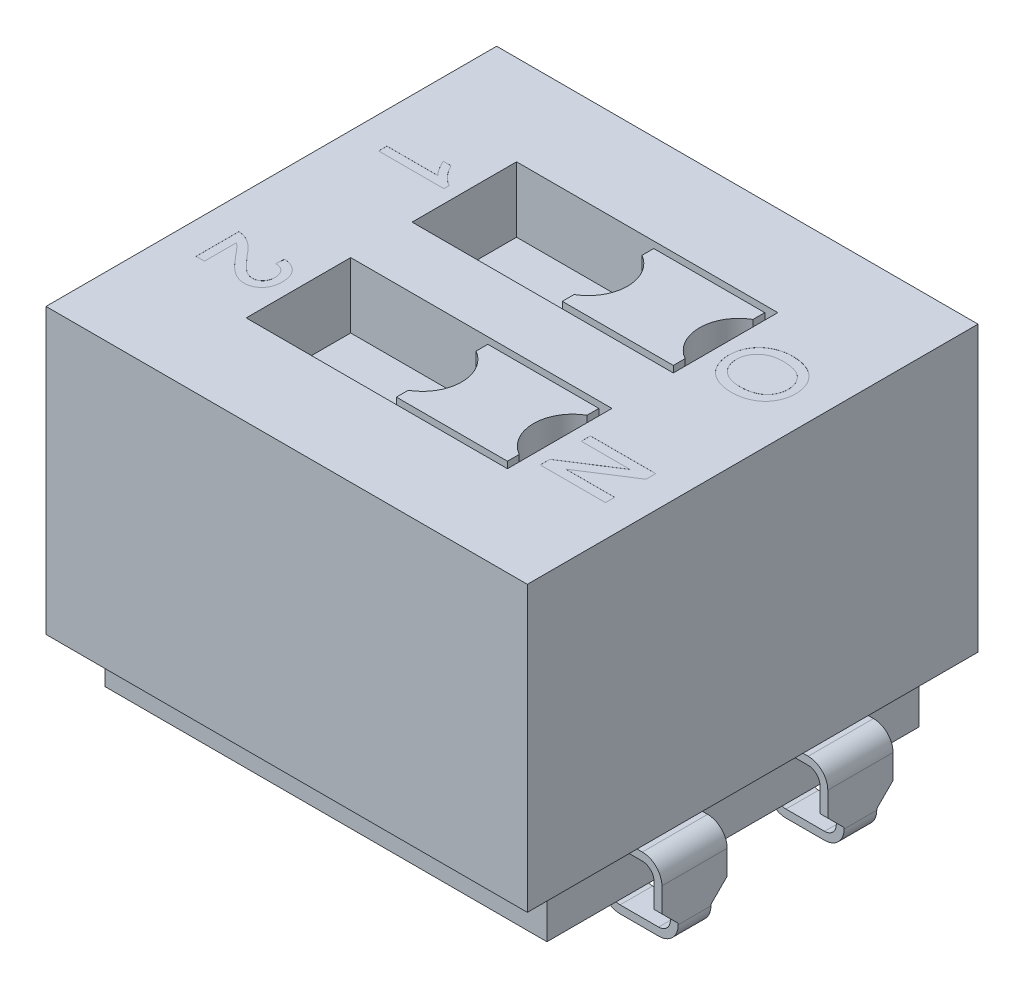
SolidWorks part; units mm, degrees
ref_plane "Front" through (0, 0, 0) normal (0, 0, 1) x (1, 0, 0)
ref_plane "Top" through (0, 0, 0) normal (0, 1, 0) x (1, 0, 0)
ref_plane "Right" through (0, 0, 0) normal (1, 0, 0) x (0, 0, -1)
ref_plane "Плоскость2" through (0, 0, -1.27) normal (0, 0, 1) x (1, 0, 0)
sketch "Эскиз1" plane through (0, 0, -1.27) normal (0, 0, 1) x (1, 0, 0)
  line L0 (-3.175, 0) -> (-3.765, 0)
  line L1 (-4.065, 0.3) -> (-4.065, 0.94)
  line L2 (-3.765, 1.24) -> (0, 1.24)
  line L3 (0, 1.24) -> (0, 0) construction
  line L4 (-2.875, 0.3) -> (-2.875, 0.32)
  line L5 (-2.995, 0.3) -> (-2.995, 0.32)
  line L6 (-3.175, 0.12) -> (-3.765, 0.12)
  line L7 (-3.945, 0.3) -> (-3.945, 0.94)
  line L8 (-3.765, 1.12) -> (0, 1.12)
  line L9 (-2.995, 0.32) -> (-2.875, 0.32)
  line L10 (2.995, 0.32) -> (2.875, 0.32)
  line L11 (3.765, 1.12) -> (0, 1.12)
  line L12 (3.945, 0.3) -> (3.945, 0.94)
  line L13 (3.175, 0.12) -> (3.765, 0.12)
  line L14 (2.995, 0.3) -> (2.995, 0.32)
  line L15 (2.875, 0.3) -> (2.875, 0.32)
  line L16 (3.765, 1.24) -> (0, 1.24)
  line L17 (4.065, 0.3) -> (4.065, 0.94)
  line L18 (3.175, 0) -> (3.765, 0)
  arc A0 (-3.175, 0) -> (-2.875, 0.3) centre (-3.175, 0.3) ccw
  arc A1 (-3.765, 0) -> (-4.065, 0.3) centre (-3.765, 0.3) cw
  arc A2 (-4.065, 0.94) -> (-3.765, 1.24) centre (-3.765, 0.94) cw
  arc A3 (-3.175, 0.12) -> (-2.995, 0.3) centre (-3.175, 0.3) ccw
  arc A4 (-3.765, 0.12) -> (-3.945, 0.3) centre (-3.765, 0.3) cw
  arc A5 (-3.945, 0.94) -> (-3.765, 1.12) centre (-3.765, 0.94) cw
  arc A6 (3.945, 0.94) -> (3.765, 1.12) centre (3.765, 0.94) ccw
  arc A7 (3.765, 0.12) -> (3.945, 0.3) centre (3.765, 0.3) ccw
  arc A8 (3.175, 0.12) -> (2.995, 0.3) centre (3.175, 0.3) cw
  arc A9 (4.065, 0.94) -> (3.765, 1.24) centre (3.765, 0.94) ccw
  arc A10 (3.765, 0) -> (4.065, 0.3) centre (3.765, 0.3) ccw
  arc A11 (3.175, 0) -> (2.875, 0.3) centre (3.175, 0.3) cw
  dimension "D1" = 0.3
  dimension "D2" = 0.12
  dimension "D4" = 6.35
  dimension "D5" = 1
  dimension "D6" = 0.2
  dimension "D3" = 8.13
extrude "Вытянуть1" add sketch "Эскиз1" along normal mid plane 1
sketch "Эскиз6" plane through (0, 0, 0) normal (1, 0, 0) x (0, 0, -1)
  line L0 (1.02, 0) -> (1.02, 0.32)
  line L1 (0.77, 0) -> (1.77, 0) construction
  line L2 (1.02, 0.32) -> (0.77, 0.57)
  line L3 (0.77, 0.57) -> (0.77, 0)
  line L4 (0.77, 0) -> (1.02, 0)
  line L5 (1.27, 0) -> (1.27, 1.24) construction
  line L6 (0.77, 1.24) -> (1.77, 1.24) construction
  line L7 (1.77, 0) -> (1.52, 0)
  line L8 (1.77, 0.57) -> (1.77, 0)
  line L9 (1.52, 0.32) -> (1.77, 0.57)
  line L10 (1.52, 0) -> (1.52, 0.32)
  line L11 (0.77, 0.32) -> (1.77, 0.32) construction
  dimension "D1" = 45
  dimension "D2" = 0.5
extrude "Вытянуть4" cut sketch "Эскиз6" against normal through all and the other way through all
ref_plane "Плоскость1" through (0, 5.59, 0) normal (0, 1, 0) x (-1, 0, 0)
sketch "Эскиз2" plane through (0, 5.59, 0) normal (0, 1, 0) x (-1, 0, 0)
  line L0 (0, -3.45) -> (0, 3.45) construction
  line L1 (3.685, -3.45) -> (-3.685, -3.45)
  line L2 (3.685, -3.45) -> (3.685, 3.45)
  line L3 (3.685, 3.45) -> (-3.685, 3.45)
  line L4 (-3.685, -3.45) -> (-3.685, 3.45)
  dimension "D2" = 6.9
  dimension "D3" = 7.37
extrude "Вытянуть2" add sketch "Эскиз2" against normal up to surface (4.35 mm away)
sketch "Эскиз4" plane through (0, 5.59, 0) normal (0, 1, 0) x (-1, 0, 0)
  line L0 (-0.2, -1.97) -> (-1.9, -1.97)
  line L1 (2, -2.07) -> (-2, -2.07)
  line L2 (2, -2.07) -> (2, -0.47)
  line L3 (2, -0.47) -> (-2, -0.47)
  line L4 (-2, -2.07) -> (-2, -0.47)
  line L5 (-1.9, -1.97) -> (-1.9, -1.7896)
  line L6 (-0.2, -0.57) -> (-1.9, -0.57)
  line L7 (-0.2, -0.57) -> (-0.2, -0.7504)
  line L8 (2.6938, -1.27) -> (0, -1.27) construction
  line L9 (0, -1.27) -> (0, -3.45) construction
  line L10 (-3.685, -3.45) -> (3.685, -3.45) construction
  line L11 (2, -1.97) -> (-1.9, -1.97) construction
  line L12 (2, -0.57) -> (-1.9, -0.57) construction
  line L13 (-0.2, -1.7896) -> (-0.2, -1.97)
  line L14 (-1.9, -0.7504) -> (-1.9, -0.57)
  line L15 (-1.9, -1.97) -> (-1.9, -0.57) construction
  line L16 (1.0447, -1.27) -> (-1.0447, -1.27) construction
  arc A0 (-1.9, -1.7896) -> (-1.9, -0.7504) centre (-2.2, -1.27) ccw
  arc A2 (-0.2, -0.7504) -> (-0.2, -1.7896) centre (0.1, -1.27) ccw
  dimension "D6" = 0.6
  dimension "D2" = 4
  dimension "D3" = 1.6
  dimension "D4" = 1.7
  dimension "D5" = 0.1
  dimension "D1" = 0.1
extrude "Вырез-Вытянуть1" cut sketch "Эскиз4" against normal blind 1
sketch "Эскиз5"
  dimension "D1" = 3.2
  dimension "D2" = 2.2
  dimension "D3" = 0.4
extrude "Вырез-Вытянуть2" cut sketch "Эскиз5" against normal blind 0.001
pattern_linear "Линейный массив1" count 2 spacing 2.54 along (0, 0, 1) of "Вытянуть1", "Вытянуть4"
sketch "Эскиз3" plane through (0, 1.24, 0) normal (0, -1, 0) x (1, 0, 0)
  line L0 (-3.685, 0) -> (3.685, 0) construction
  line L1 (-3.385, 2.85) -> (3.385, 2.85)
  line L2 (-3.385, 2.85) -> (-3.385, -2.85)
  line L3 (-3.385, -2.85) -> (3.385, -2.85)
  line L4 (3.385, 2.85) -> (3.385, -2.85)
  line L5 (-3.685, -3.45) -> (-3.685, -1.77) construction
  line L7 (0, 3.45) -> (0, -3.45) construction
  line L8 (-3.685, 3.45) -> (3.685, 3.45) construction
  line L9 (3.685, -3.45) -> (-3.685, -3.45) construction
  line L10 (-3.685, -3.45) -> (-3.685, 3.45) construction
  dimension "D1" = 0.6
  dimension "D2" = 0.3
extrude "Вытянуть3" add sketch "Эскиз3" along normal offset from surface (0.84 mm away) 5.19
pattern_linear "Линейный массив2" count 2 spacing 2.54 along (0, 0, 1) of "Вырез-Вытянуть1"
